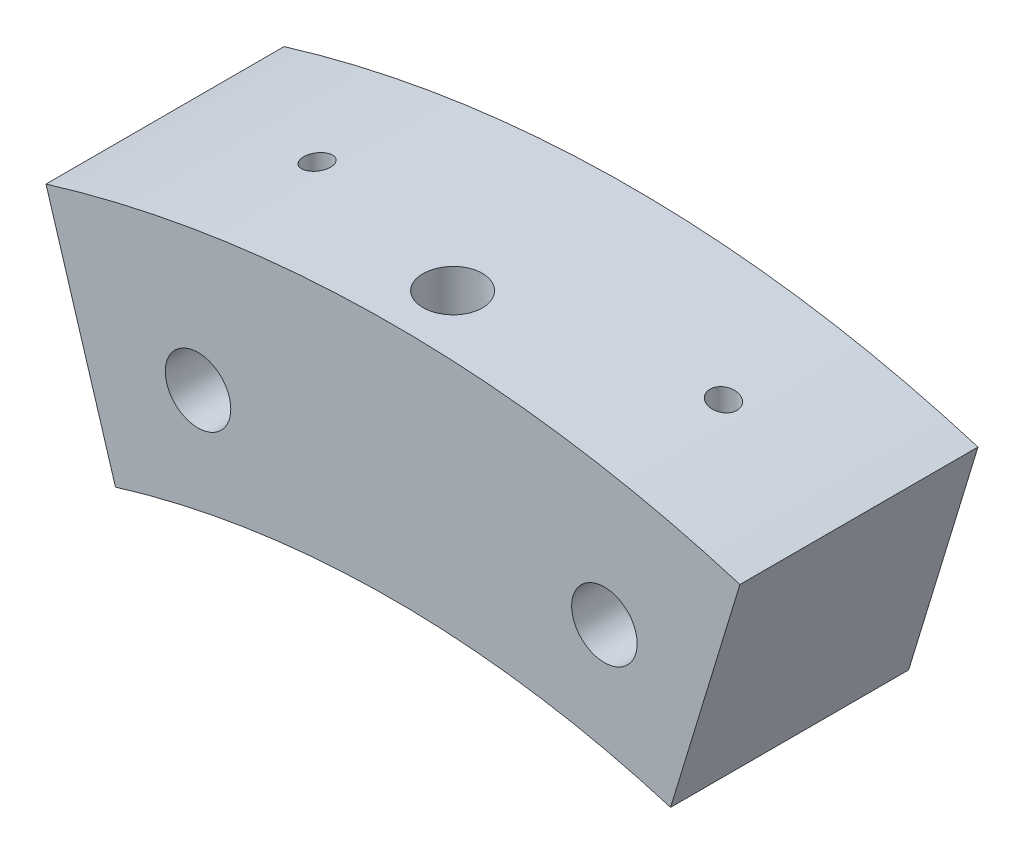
SolidWorks part; units mm, degrees
ref_plane "Front" through (0, 0, 0) normal (0, 0, 1) x (1, 0, 0)
ref_plane "Top" through (0, 0, 0) normal (0, 1, 0) x (1, 0, 0)
ref_plane "Right" through (0, 0, 0) normal (1, 0, 0) x (0, 0, -1)
sketch "Sketch1" plane through (0, 0, 0) normal (0, 0, 1) x (1, 0, 0)
  line L0 (27.7542, 91.1168) -> (34.6964, 113.9081)
  line L1 (-27.7948, 91.1044) -> (-34.7472, 113.8926)
  line L2 (0, 0) -> (0, 125.3564) construction
  arc A0 (27.7542, 91.1168) -> (-27.7948, 91.1044) centre (0, 0) ccw
  arc A1 (34.6964, 113.9081) -> (-34.7472, 113.8926) centre (0, 0) ccw
  dimension "D1" = 238.1504
  dimension "D2" = 190.5
  dimension "D3" = 69.4436
  dimension "D4" = 34.6964
extrude "Boss-Extrude1" add sketch "Sketch1" along normal blind 23.8252
sketch "Sketch2" plane through (0, 0, 23.8252) normal (0, 0, 1) x (1, 0, 0)
  line L0 (0, 0) -> (0, 124.689) construction
ref_plane "Plane1" through (0, 119.0752, 0) normal (0, 1, 0) x (-1, 0, 0)
sketch "Sketch3" plane through (0, 119.0752, 0) normal (0, 1, 0) x (-1, 0, 0)
  line L0 (34.7472, 23.8252) -> (-34.6964, 23.8252) construction
  circle A0 centre (0, 17.8816) radius 1.7844
  dimension "D1" = 3.5687
  dimension "D2" = 5.9436
extrude "Cut-Extrude1" cut sketch "Sketch3" against normal through all
hole_wizard "#6-32 Tapped Hole1" positions "Sketch5" profile "Sketch6" tap size "#6-32" standard "ANSI Inch"
sketch "Sketch5" plane through (0, 119.0752, 0) normal (0, 1, 0) x (-1, 0, 0)
  line L0 (34.7472, 23.8252) -> (-34.6964, 23.8252) construction
  point P0 (19.5326, 11.9126)
  point P2 (-21.1328, 11.9126)
  dimension "D1" = 19.5326
  dimension "D2" = 21.1328
  dimension "D3" = 11.9126
  dimension "D4" = 11.9126
sketch "Sketch6" plane through (-19.5326, 119.0752, 11.9126) normal (1, 0, 0) x (0, 0, 1)
  line L0 (0, 0) -> (0, 18.7959)
  line L1 (0, 18.7959) -> (1.3525, 17.9832)
  line L2 (1.3525, 17.9832) -> (1.3525, 0)
  line L5 (1.3525, 0) -> (0, 0)
  line L10 (0, 18.7959) -> (-1.3526, 17.9832) construction
  line L11 (0, -6.35) -> (0, 107.95) construction
  dimension "Tap Drill Dia." = 2.7051
  dimension "Tap Drill Depth" = 17.9832
  dimension "Drill Angle" = 118
sketch "Sketch7" plane through (0, 0, 23.8252) normal (0, 0, 1) x (1, 0, 0)
  line L0 (0, 0) -> (0, 124.689) construction
  line L1 (13.1039, 119.0752) -> (-13.1039, 119.0752) construction
  circle A0 centre (-19.5326, 103.632) radius 3.2766
  circle A1 centre (21.1328, 103.632) radius 3.2766
  dimension "D1" = 6.5532
  dimension "D2" = 6.5532
  dimension "D3" = 19.5326
  dimension "D4" = 21.1328
  dimension "D5" = 15.4432
  dimension "D6" = 15.4432
extrude "Cut-Extrude2" cut sketch "Sketch7" against normal through all
sketch "Sketch8" plane through (0, 119.0752, 0) normal (0, 1, 0) x (-1, 0, 0)
  circle A0 centre (0, 17.8816) radius 2.9718
  dimension "D1" = 5.9436
extrude "Cut-Extrude3" cut sketch "Sketch8" against normal blind 5.461
